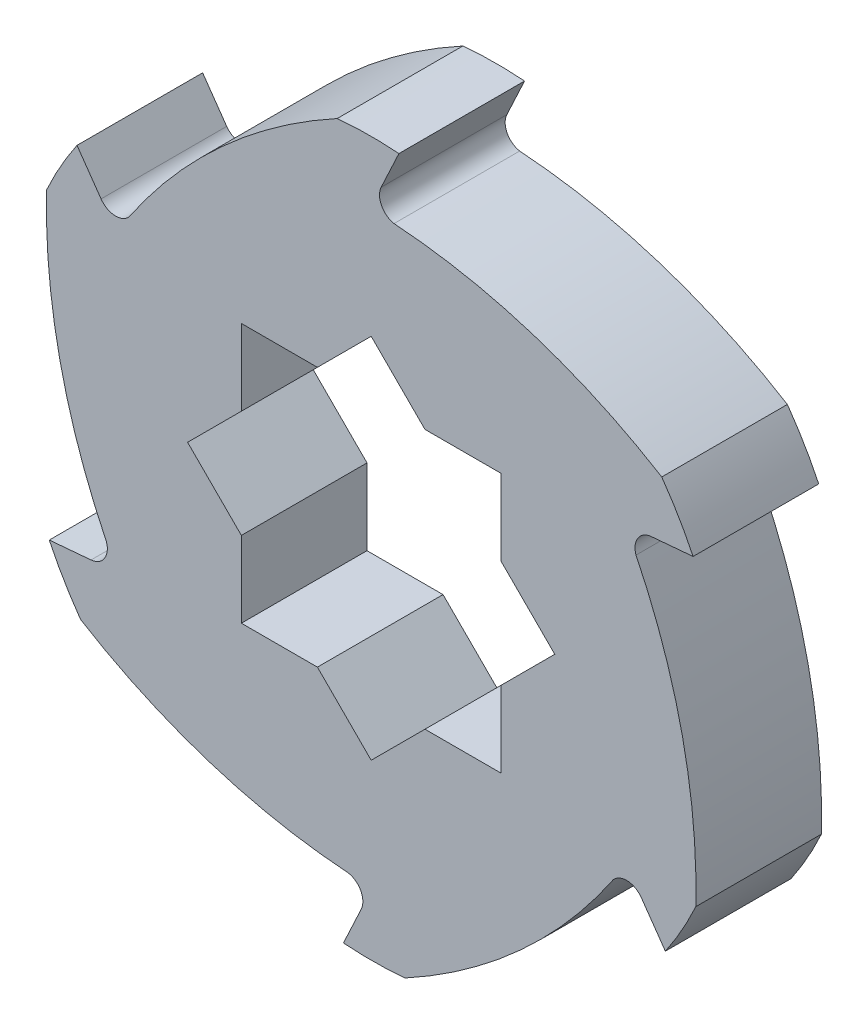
SolidWorks part; units mm, degrees
ref_plane "Front Plane" through (0, 0, 0) normal (0, 0, 1) x (1, 0, 0)
ref_plane "Top Plane" through (0, 0, 0) normal (0, 1, 0) x (1, 0, 0)
ref_plane "Right Plane" through (0, 0, 0) normal (1, 0, 0) x (0, 0, -1)
ref_plane "Plane1" through (0, 0, -1.05) normal (0, 0, -1) x (-1, 0, 0)
sketch "Sketch1" plane through (0, 0, -1.05) normal (0, 0, -1) x (-1, 0, 0)
  line L5 (10.6066, -10.6066) -> (-10.6066, 10.6066) construction
  line L6 (35.1257, 24.1028) -> (32.2533, 20.0006)
  line L7 (-3.3108, 42.4712) -> (-1.1944, 37.9325)
  line L8 (38.4365, -18.3684) -> (33.4477, -17.9319)
  line L9 (3.3108, -42.4712) -> (1.1944, -37.9325)
  line L10 (-35.1257, -24.1028) -> (-32.2533, -20.0006)
  line L11 (-38.4365, 18.3684) -> (-33.4477, 17.9319)
  line L12 (10.6066, 10.6066) -> (-10.6066, -10.6066) construction
  line L24 (-15.5, 6.4203) -> (-15.5, 15.5)
  line L25 (-6.4203, 15.5) -> (-15.5, 15.5)
  line L26 (0, 21.9203) -> (-6.4203, 15.5)
  line L27 (6.4203, 15.5) -> (0, 21.9203)
  line L28 (15.5, 15.5) -> (6.4203, 15.5)
  line L29 (15.5, 6.4203) -> (15.5, 15.5)
  line L30 (21.9203, 0) -> (15.5, 6.4203)
  line L31 (21.9203, 0) -> (15.5, -6.4203)
  line L32 (15.5, -15.5) -> (15.5, -6.4203)
  line L33 (15.5, -15.5) -> (6.4203, -15.5)
  line L34 (6.4203, -15.5) -> (0, -21.9203)
  line L35 (0, -21.9203) -> (-6.4203, -15.5)
  line L36 (-6.4203, -15.5) -> (-15.5, -15.5)
  line L37 (-15.5, -15.5) -> (-15.5, -6.4203)
  line L38 (-15.5, -6.4203) -> (-21.9203, 0)
  line L39 (-15.5, 6.4203) -> (-21.9203, 0)
  arc A0 (32.2533, 20.0006) -> (28.8947, 19.8322) centre (30.5085, 21.2223) cw
  arc A1 (38.7554, 17.6856) -> (35.1257, 24.1028) centre (0, 0) ccw
  arc A2 (33.4477, -17.9319) -> (31.6225, -15.1074) centre (33.6333, -15.81) cw
  arc A3 (34.6939, -24.7204) -> (38.4365, -18.3684) centre (0, 0) ccw
  arc A4 (4.0615, 42.4059) -> (-3.3108, 42.4712) centre (0, 0) ccw
  arc A5 (-1.1944, 37.9325) -> (-2.7279, 34.9396) centre (-3.1248, 37.0323) cw
  arc A6 (1.1944, -37.9325) -> (2.7279, -34.9396) centre (3.1248, -37.0323) cw
  arc A7 (-4.0615, -42.4059) -> (3.3108, -42.4712) centre (0, 0) ccw
  arc A8 (-32.2533, -20.0006) -> (-28.8947, -19.8322) centre (-30.5085, -21.2223) cw
  arc A9 (-38.7554, -17.6856) -> (-35.1257, -24.1028) centre (0, 0) ccw
  arc A10 (-33.4477, 17.9319) -> (-31.6225, 15.1074) centre (-33.6333, 15.81) cw
  arc A11 (-34.6939, 24.7204) -> (-38.4365, 18.3684) centre (0, 0) ccw
  arc A12 (-34.6939, 24.7204) -> (-2.7279, 34.9396) centre (2.1734, -35.4961) cw
  arc A13 (4.0615, 42.4059) -> (28.8947, 19.8322) centre (-29.6539, -19.6302) cw
  arc A14 (38.7554, 17.6856) -> (31.6225, -15.1074) centre (-31.8272, 15.8659) cw
  arc A15 (34.6939, -24.7204) -> (2.7279, -34.9396) centre (-2.1734, 35.4961) cw
  arc A16 (-4.0615, -42.4059) -> (-28.8947, -19.8322) centre (29.6539, 19.6302) cw
  arc A17 (-38.7554, -17.6856) -> (-31.6225, 15.1074) centre (31.8272, -15.8659) cw
  point P1 (0, 25)
  point P39 (0, 0)
  point P46 (0, 0)
  point P52 (0, 0)
  point P56 (0, 0)
  dimension "D1" = 6
  dimension "D2" = 6
extrude "Boss-Extrude1" add sketch "Sketch1" against normal blind 15
pattern_linear "LPattern1" [suppressed] count 7 spacing 50
